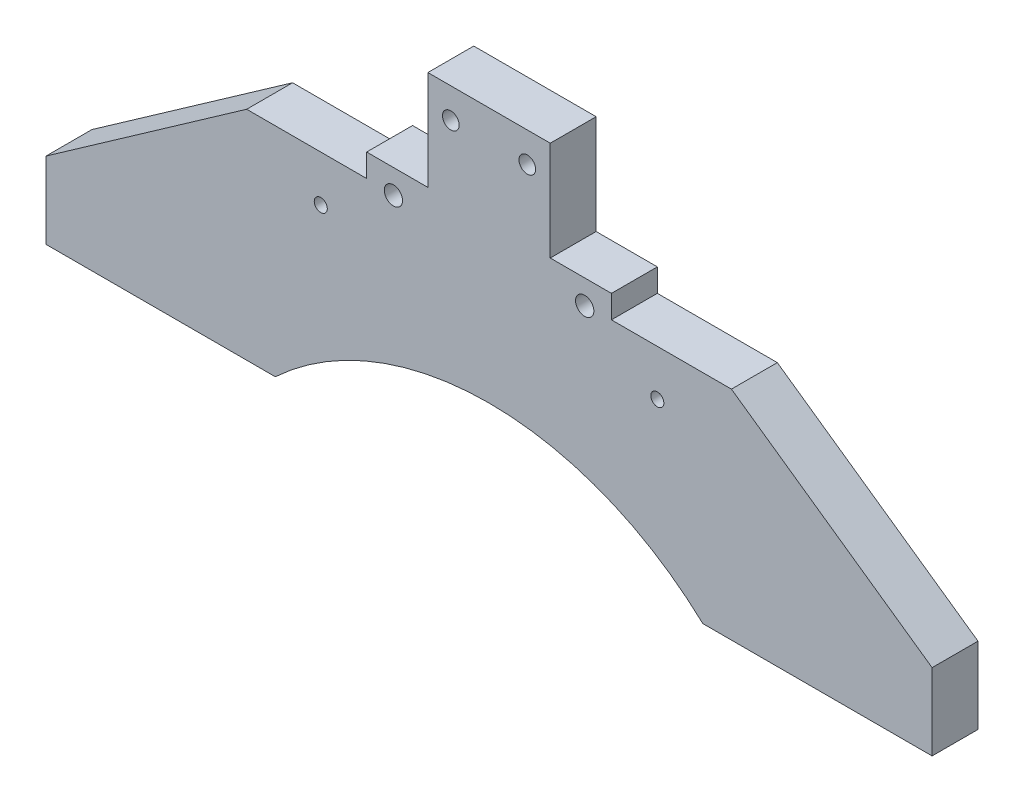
SolidWorks part; units mm, degrees
ref_plane "Front Plane" through (0, 0, 0) normal (0, 0, 1) x (1, 0, 0)
ref_plane "Top Plane" through (0, 0, 0) normal (0, 1, 0) x (1, 0, 0)
ref_plane "Right Plane" through (0, 0, 0) normal (1, 0, 0) x (0, 0, -1)
sketch "Sketch1" plane through (0, 0, 0) normal (0, 0, 1) x (1, 0, 0)
  line L0 (54.3067, 0) -> (91.948, 0)
  line L1 (-50.3006, 45.1104) -> (-25.4, 45.1104)
  line L2 (-91.948, 15.875) -> (-91.948, 0)
  line L3 (-91.948, 0) -> (-54.3067, 0)
  line L4 (91.948, 15.875) -> (91.948, 0)
  line L5 (0, 49.3153) -> (0, 0) construction
  line L6 (-12.7, 49.8729) -> (-12.7, 70.5104)
  line L7 (-12.7, 70.5104) -> (12.7, 70.5104)
  line L8 (12.7, 70.5104) -> (12.7, 49.8729)
  line L9 (0, 70.5104) -> (0, 49.3153) construction
  line L10 (25.4, 45.1104) -> (50.3006, 45.1104)
  line L11 (91.948, 24.6576) -> (-91.948, 24.6576) construction
  line L12 (91.948, 15.875) -> (50.3006, 45.1104)
  line L13 (-91.948, 15.875) -> (-50.3006, 45.1104)
  line L14 (-82.55, 34.925) -> (82.55, -130.175) construction
  line L15 (-82.55, 34.925) -> (82.55, 34.925) construction
  line L16 (-82.55, 34.925) -> (-82.55, -130.175) construction
  line L17 (-82.55, -130.175) -> (82.55, -130.175) construction
  line L18 (82.55, 34.925) -> (82.55, -130.175) construction
  line L19 (-25.4, 45.1104) -> (-25.4, 49.8729)
  line L20 (88.9003, 34.0103) -> (86.5173, 39.9672) construction
  line L21 (86.5173, 39.9672) -> (80.167, 40.8818) construction
  line L22 (80.167, 40.8818) -> (76.1997, 35.8397) construction
  line L23 (76.1997, 35.8397) -> (78.5827, 29.8828) construction
  line L24 (78.5827, 29.8828) -> (84.933, 28.9682) construction
  line L25 (84.933, 28.9682) -> (88.9003, 34.0103) construction
  line L26 (-25.4, 49.8729) -> (-12.7, 49.8729)
  line L27 (25.4, 49.8729) -> (25.4, 45.1104)
  line L28 (12.7, 49.8729) -> (25.4, 49.8729)
  arc A0 (54.3067, 0) -> (-54.3067, 0) centre (0, -47.625) ccw
  circle A1 centre (82.55, 34.925) radius 5.5563 construction
  point P17 (0, 24.6576)
  point P24 (0, -47.625)
  dimension "D2" = 47.625
  dimension "D3" = 72.2313
  dimension "D10" = 11.1125
  dimension "D1" = 183.896
  dimension "D4" = 15.875
  dimension "D5" = 45.1104
  dimension "D6" = 91.948
  dimension "D7" = 25.4
  dimension "D8" = 25.4
  dimension "D9" = 165.1
  dimension "D11" = 25.4
  dimension "D12" = 25.4
  dimension "D13" = 4.7625
extrude "Boss-Extrude1" add sketch "Sketch1" along normal blind 9.525
sketch "Sketch7" plane through (0, 0, 9.525) normal (0, 0, 1) x (1, 0, 0)
  line L0 (54.3067, 0) -> (44.3649, 0)
  line L1 (-54.3067, 0) -> (-44.3649, 0)
  arc A0 (54.3067, 0) -> (-54.3067, 0) centre (0, -47.625) ccw construction
  arc A1 (54.3067, 0) -> (-54.3067, 0) centre (0, -47.625) ccw
  arc A2 (44.3649, 0) -> (-44.3649, 0) centre (0, -47.625) ccw
  dimension "D1" = 65.0875
extrude "Boss-Extrude2" add sketch "Sketch7" against normal blind 6.35
hole_wizard "#8-32 Tapped Hole6" positions "Sketch3" profile "Sketch2" tap size "#8-32" standard "ANSI Inch"
sketch "Sketch3" plane through (0, 0, 9.525) normal (0, 0, 1) x (1, 0, 0)
  line L0 (50.3006, 45.1104) -> (25.4, 45.1104) construction
  point P0 (-7.9375, 64.2874)
  point P1 (7.9375, 64.2874)
  dimension "D1" = 19.177
  dimension "D2" = 7.9375
  dimension "D3" = 7.9375
sketch "Sketch2" plane through (-7.9375, 64.2874, 9.525) normal (1, 0, 0) x (0, -1, 0)
  line L0 (0, 0) -> (0, 9.525)
  line L1 (0, 9.525) -> (1.7272, 9.525)
  line L2 (1.7272, 9.525) -> (1.7272, 0)
  line L5 (1.7272, 0) -> (0, 0)
  line L11 (0, -6.35) -> (0, 107.95) construction
  dimension "Thru Tap Drill Dia." = 3.4544
  dimension "Thru Tap Drill Depth" = 9.525
hole_wizard "CBORE for #6 Socket Head Cap Screw1" positions "Sketch5" profile "Sketch4" counterbore size "#6" standard "ANSI Inch"
sketch "Sketch5" plane through (0, 0, 0) normal (0, 0, -1) x (-1, 0, 0)
  line L0 (91.948, 0) -> (54.3067, 0) construction
  point P0 (-19.8501, 44.8564)
  point P1 (19.8501, 44.8564)
  dimension "D1" = 44.8564
  dimension "D2" = 19.8501
  dimension "D3" = 19.8501
sketch "Sketch4" plane through (19.8501, 44.8564, 0) normal (1, 0, 0) x (0, 1, 0)
  line L0 (0, 0) -> (0, 9.525)
  line L1 (0, 9.525) -> (1.8987, 9.525)
  line L3 (1.8987, 9.525) -> (1.8987, 3.5052)
  line L4 (1.8987, 3.5052) -> (3.5725, 3.5052)
  line L5 (3.5725, 3.5052) -> (3.5725, 0)
  line L7 (3.5725, 0) -> (0, 0)
  line L11 (0, -6.35) -> (0, 107.95) construction
  dimension "Thru Hole Dia." = 3.7973
  dimension "Thru Hole Depth" = 9.525
  dimension "C'Bore Dia." = 7.145
  dimension "C'Bore Depth" = 3.5052
hole_wizard "#6-32 Tapped Hole2" positions "Sketch13" profile "Sketch12" tap size "#6-32" standard "ANSI Inch"
sketch "Sketch13" plane through (0, 0, 0) normal (0, 0, -1) x (-1, 0, 0)
  arc A0 (54.3067, 0) -> (-54.3067, 0) centre (0, -47.625) ccw construction
  point P1 (-34.925, 35.5854)
  point P8 (34.925, 35.5854)
  dimension "D1" = 34.925
  dimension "D2" = 83.2104
  dimension "D3" = 34.925
sketch "Sketch12" plane through (34.925, 35.5854, 0) normal (1, 0, 0) x (0, 1, 0)
  line L0 (0, 0) -> (0, 11.7855)
  line L1 (0, 11.7855) -> (1.3525, 10.9728)
  line L2 (1.3525, 10.9728) -> (1.3525, 0)
  line L5 (1.3525, 0) -> (0, 0)
  line L10 (0, 11.7855) -> (-1.3526, 10.9728) construction
  line L11 (0, -6.35) -> (0, 107.95) construction
  dimension "Tap Drill Dia." = 2.7051
  dimension "Tap Drill Depth" = 10.9728
  dimension "Drill Angle" = 118
equation "\"Buoyancy\"= \"SW-Volume\" * ( \"SW-Density\" - .037062 )"
equation "\"2.0OO\"=2.01176"
